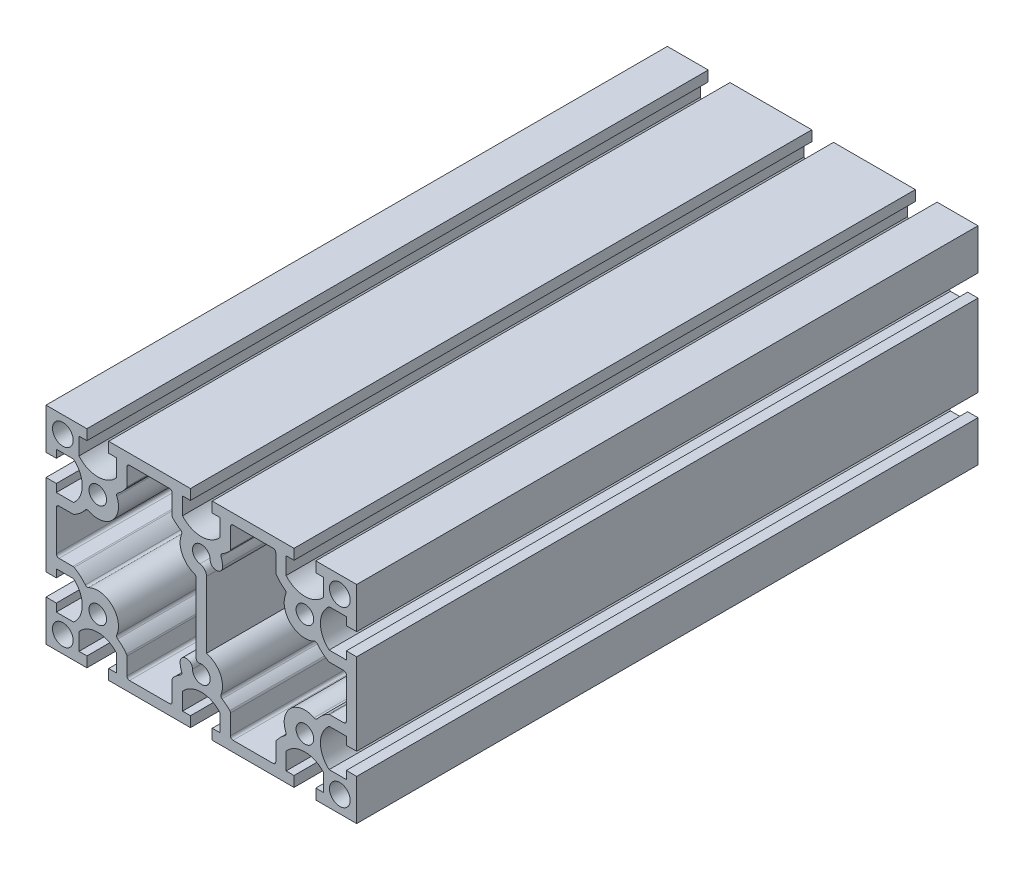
SolidWorks part; units mm, degrees
ref_plane "前基準面" through (0, 0, 0) normal (0, 0, 1) x (1, 0, 0)
ref_plane "上基準面" through (0, 0, 0) normal (0, 1, 0) x (1, 0, 0)
ref_plane "右基準面" through (0, 0, 0) normal (1, 0, 0) x (0, 0, -1)
sketch "草圖1" plane through (0, 0, 0) normal (0, 0, 1) x (1, 0, 0)
  line L0 (0, 40) -> (0, -40) construction
  line L1 (0, 0) -> (60, 0) construction
  line L2 (4.2, 40) -> (35.8, 40)
  line L3 (60, 40) -> (60, 24.2)
  line L4 (60, 20) -> (46, 20) construction
  line L5 (60, 24.2) -> (56, 24.2)
  line L6 (60, 15.8) -> (56, 15.8)
  line L7 (56, 27.25) -> (49.361, 27.25)
  line L8 (56, 27.25) -> (56, 24.2)
  line L9 (0, 36) -> (56, 36) construction
  line L10 (60, 15.8) -> (60, -15.8)
  line L11 (60, 40) -> (60, 0) construction
  line L12 (56, 12.75) -> (49.361, 12.75)
  line L13 (60, 27.25) -> (27.9715, 27.25) construction
  line L14 (60, 12.75) -> (27.9715, 12.75) construction
  line L15 (56, 36) -> (56, 0) construction
  line L16 (40, 40) -> (40, 29.3752) construction
  line L17 (60, 24.2) -> (27.9715, 24.2) construction
  line L18 (60, 20) -> (27.9715, 20) construction
  line L19 (60, 15.8) -> (27.9715, 15.8) construction
  line L20 (56, 15.8) -> (56, 12.75)
  line L21 (32.75, 36) -> (35.8, 36)
  line L22 (35.8, 40) -> (35.8, 36)
  line L23 (44.2, 40) -> (44.2, 36)
  line L24 (44.2, 36) -> (47.25, 36)
  line L25 (32.75, 36) -> (32.75, 29.361)
  line L26 (44.2, 40) -> (60, 40)
  line L27 (47.25, 36) -> (47.25, 29.361)
  line L28 (0, 40) -> (60, 40) construction
  line L29 (4.2, 40) -> (4.2, 36)
  line L30 (7.25, 36) -> (7.25, 29.361)
  line L31 (4.2, 36) -> (7.25, 36)
  line L32 (-40, 40) -> (-40, 29.3752) construction
  line L33 (-60, 20) -> (-46, 20) construction
  line L34 (-4.2, 36) -> (-7.25, 36)
  line L35 (-7.25, 36) -> (-4.2, 36)
  line L36 (-7.25, 36) -> (-7.25, 29.361)
  line L37 (-4.2, 40) -> (-4.2, 36)
  line L38 (-7.25, 36) -> (-7.25, 29.361)
  line L39 (-4.2, 40) -> (-4.2, 36)
  line L40 (-47.25, 36) -> (-47.25, 29.361)
  line L41 (-44.2, 40) -> (-60, 40)
  line L42 (-32.75, 36) -> (-32.75, 29.361)
  line L43 (-44.2, 36) -> (-47.25, 36)
  line L44 (-44.2, 40) -> (-44.2, 36)
  line L45 (-35.8, 40) -> (-35.8, 36)
  line L46 (-32.75, 36) -> (-35.8, 36)
  line L47 (-56, 15.8) -> (-56, 12.75)
  line L48 (-56, 12.75) -> (-49.361, 12.75)
  line L49 (-60, 15.8) -> (-60, -15.8)
  line L50 (-56, 27.25) -> (-56, 24.2)
  line L51 (-56, 27.25) -> (-49.361, 27.25)
  line L52 (-60, 15.8) -> (-56, 15.8)
  line L53 (-60, 24.2) -> (-56, 24.2)
  line L54 (-60, 40) -> (-60, 24.2)
  line L55 (-4.2, 40) -> (-35.8, 40)
  line L56 (-60, -20) -> (-46, -20) construction
  line L57 (-40, -40) -> (-40, -29.3752) construction
  line L58 (40, -40) -> (40, -29.3752) construction
  line L59 (60, -20) -> (46, -20) construction
  line L60 (-4.2, -40) -> (-35.8, -40)
  line L61 (-60, -40) -> (-60, -24.2)
  line L62 (-60, -24.2) -> (-56, -24.2)
  line L63 (-60, -15.8) -> (-56, -15.8)
  line L64 (-56, -27.25) -> (-49.361, -27.25)
  line L65 (-56, -27.25) -> (-56, -24.2)
  line L66 (-56, -12.75) -> (-49.361, -12.75)
  line L67 (-56, -15.8) -> (-56, -12.75)
  line L68 (-32.75, -36) -> (-35.8, -36)
  line L69 (-35.8, -40) -> (-35.8, -36)
  line L70 (-44.2, -40) -> (-44.2, -36)
  line L71 (-44.2, -36) -> (-47.25, -36)
  line L72 (-32.75, -36) -> (-32.75, -29.361)
  line L73 (-44.2, -40) -> (-60, -40)
  line L74 (-47.25, -36) -> (-47.25, -29.361)
  line L75 (-4.2, -40) -> (-4.2, -36)
  line L76 (-7.25, -36) -> (-7.25, -29.361)
  line L77 (-4.2, -36) -> (-7.25, -36)
  line L78 (4.2, -36) -> (7.25, -36)
  line L79 (7.25, -36) -> (7.25, -29.361)
  line L80 (4.2, -40) -> (4.2, -36)
  line L81 (47.25, -36) -> (47.25, -29.361)
  line L82 (44.2, -40) -> (60, -40)
  line L83 (32.75, -36) -> (32.75, -29.361)
  line L84 (44.2, -36) -> (47.25, -36)
  line L85 (44.2, -40) -> (44.2, -36)
  line L86 (35.8, -40) -> (35.8, -36)
  line L87 (32.75, -36) -> (35.8, -36)
  line L88 (56, -15.8) -> (56, -12.75)
  line L89 (56, -12.75) -> (49.361, -12.75)
  line L90 (56, -27.25) -> (56, -24.2)
  line L91 (56, -27.25) -> (49.361, -27.25)
  line L92 (60, -15.8) -> (56, -15.8)
  line L93 (60, -24.2) -> (56, -24.2)
  line L94 (60, -40) -> (60, -24.2)
  line L95 (4.2, -40) -> (35.8, -40)
  arc A0 (49.361, 27.25) -> (49.361, 12.75) centre (55.5, 20) ccw
  arc A1 (32.75, 29.361) -> (47.25, 29.361) centre (40, 35.5) ccw
  arc A2 (-7.25, 29.361) -> (7.25, 29.361) centre (0, 35.5) ccw
  arc A3 (-32.75, 29.361) -> (-47.25, 29.361) centre (-40, 35.5) cw
  arc A4 (-49.361, 27.25) -> (-49.361, 12.75) centre (-55.5, 20) cw
  arc A5 (-49.361, -27.25) -> (-49.361, -12.75) centre (-55.5, -20) ccw
  arc A6 (-32.75, -29.361) -> (-47.25, -29.361) centre (-40, -35.5) ccw
  arc A7 (-7.25, -29.361) -> (7.25, -29.361) centre (0, -35.5) cw
  arc A8 (32.75, -29.361) -> (47.25, -29.361) centre (40, -35.5) cw
  arc A9 (49.361, -27.25) -> (49.361, -12.75) centre (55.5, -20) cw
  point P109 (-60, 0)
  dimension "D10" = 4.5
  dimension "D7" = 9.5
  dimension "D13" = 9.5
  dimension "D1" = 120
  dimension "D2" = 80
  dimension "D3" = 20
  dimension "D11" = 40
  dimension "D12" = 4
  dimension "D14" = 8.4
  dimension "D15" = 14.5
  dimension "D16" = 2
  dimension "D4" = 4.2
  dimension "D5" = 4.2
  dimension "D6" = 4
  dimension "D8" = 7.25
  dimension "D9" = 7.25
extrude "填料-伸長1" add sketch "草圖1" along normal mid plane 240
sketch "草圖2" plane through (0, 0, 0) normal (0, 0, 1) x (1, 0, 0)
  line L0 (0, 0) -> (0, 40) construction
  line L1 (0, 0) -> (60, 0) construction
  line L2 (60, -15.8) -> (60, 15.8) construction
  circle A0 centre (53.5, 33.5) radius 4
  circle A1 centre (-53.5, 33.5) radius 4
  circle A2 centre (53.5, -33.5) radius 4
  circle A3 centre (-53.5, -33.5) radius 4
  circle A4 centre (40, 20) radius 3.4
  circle A5 centre (-40, 20) radius 3.4
  circle A6 centre (-40, -20) radius 3.4
  circle A7 centre (40, -20) radius 3.4
  circle A8 centre (0, 20) radius 3.4
  circle A9 centre (0, -20) radius 3.4
  dimension "D3" = 8
  dimension "D6" = 6.8
  dimension "D7" = 40
  dimension "D8" = 6.8
  dimension "D1" = 107
  dimension "D2" = 67
  dimension "D4" = 80
  dimension "D5" = 40
extrude "除料-伸長1" cut sketch "草圖2" against normal up to next and the other way up to next
sketch "草圖3" plane through (0, 0, 0) normal (0, 0, 1) x (1, 0, 0)
  line L0 (0, 0) -> (0, 40) construction
  line L1 (60, 0) -> (0, 0) construction
  line L2 (60, -15.8) -> (60, 15.8) construction
  line L3 (2, -12.0476) -> (2, 13.6786)
  line L4 (2, 0) -> (2, 40) construction
  line L5 (56, -15.8) -> (56, 15.8)
  line L6 (56, -7.75) -> (56, 7.75)
  line L7 (56, 12.75) -> (49.361, 12.75) construction
  line L9 (32.75, 29.361) -> (32.75, 36) construction
  line L10 (7.25, 36) -> (7.25, 29.361) construction
  line L11 (-2, -15.7151) -> (-2, 11.3029)
  line L12 (-11.25, 35) -> (-11.25, 27.369)
  line L13 (35.8, 36) -> (4.2, 36)
  line L14 (27.75, 36) -> (12.25, 36)
  line L15 (-27.75, 36) -> (-12.25, 36)
  line L16 (-28.75, 35) -> (-28.75, 28.3455)
  line L17 (-55, 8.75) -> (-49.6082, 8.75)
  line L18 (-56, -7.75) -> (-56, 7.75)
  line L19 (0, 0) -> (0, -40) construction
  line L20 (11.25, -35) -> (11.25, -27.369)
  line L21 (55, -8.75) -> (49.6082, -8.75)
  line L22 (28.75, -35) -> (28.75, -28.3455)
  line L23 (-55, -8.75) -> (-49.6082, -8.75)
  line L24 (-28.75, -35) -> (-28.75, -28.3455)
  line L25 (-27.75, -36) -> (-12.25, -36)
  line L26 (27.75, -36) -> (12.25, -36)
  line L27 (-11.25, -35) -> (-11.25, -27.369)
  line L88 (28.75, 35) -> (28.75, 28.3455)
  line L89 (55, 8.75) -> (49.6082, 8.75)
  line L90 (11.25, 35) -> (11.25, 27.369)
  arc A0 (44.7956, 12.5484) -> (49.1369, 8.868) centre (55.5, 20.7744) ccw
  arc A1 (55, 8.75) -> (56, 7.75) centre (55, 7.75) cw
  arc A2 (11.25, 35) -> (12.25, 36) centre (12.25, 35) cw
  arc A3 (32.6604, 23.1828) -> (43.558, 12.8347) centre (40, 20) ccw
  arc A4 (28.75, 35) -> (27.75, 36) centre (27.75, 35) ccw
  arc A5 (28.75, 28.3455) -> (28.93, 27.7731) centre (29.75, 28.3455) ccw
  arc A6 (49.6082, 8.75) -> (49.1369, 8.868) centre (49.6082, 9.75) cw
  arc A7 (43.558, 12.8347) -> (44.7956, 12.5484) centre (44.0027, 11.9391) cw
  arc A8 (32.6604, 23.1828) -> (32.3124, 24.4027) centre (31.7429, 23.5806) ccw
  arc A9 (11.25, 27.369) -> (10.9832, 26.689) centre (10.25, 27.369) cw
  arc A10 (7.6086, 23.0575) -> (8.0226, 24.2882) centre (8.5365, 23.4304) cw
  arc A11 (-2, 11.3029) -> (-2.6739, 12.2482) centre (-3, 11.3029) ccw
  arc A12 (8.0226, 24.2882) -> (10.9832, 26.689) centre (1.0851, 35.8693) ccw
  arc A13 (8.2, 20) -> (7.6086, 23.0575) centre (0, 20) ccw
  circle A14 centre (0, 20) radius 3.4 construction
  arc A15 (3.4, 20) -> (-0.5312, 16.6418) centre (0, 20) ccw
  arc A16 (8.2, 20) -> (3.4, 20) centre (5.8, 20) cw
  arc A17 (-0.5312, 16.6418) -> (2, 13.6786) centre (-1, 13.6786) cw
  arc A18 (-55, -8.75) -> (-56, -7.75) centre (-55, -7.75) cw
  arc A19 (-8.0226, -24.2882) -> (-10.9832, -26.689) centre (-1.0851, -35.8693) ccw
  arc A20 (29.6974, 26.7761) -> (50.3026, 26.7761) centre (40, 35.5) ccw
  arc A21 (28.93, 27.7731) -> (32.3124, 24.4027) centre (40, 35.5) ccw
  arc A22 (-2.6739, 12.2482) -> (-7.6086, 23.0575) centre (0, 20) cw
  arc A23 (-7.6086, 23.0575) -> (-8.0226, 24.2882) centre (-8.5365, 23.4304) ccw
  arc A24 (-8.0226, 24.2882) -> (-10.9832, 26.689) centre (-1.0851, 35.8693) cw
  arc A25 (-11.25, 27.369) -> (-10.9832, 26.689) centre (-10.25, 27.369) ccw
  arc A26 (-11.25, 35) -> (-12.25, 36) centre (-12.25, 35) ccw
  arc A27 (-28.75, 35) -> (-27.75, 36) centre (-27.75, 35) cw
  arc A28 (-28.75, 28.3455) -> (-28.93, 27.7731) centre (-29.75, 28.3455) cw
  arc A29 (-28.93, 27.7731) -> (-32.3124, 24.4027) centre (-40, 35.5) cw
  arc A30 (-32.6604, 23.1828) -> (-32.3124, 24.4027) centre (-31.7429, 23.5806) cw
  arc A31 (-32.6604, 23.1828) -> (-43.558, 12.8347) centre (-40, 20) cw
  arc A32 (-43.558, 12.8347) -> (-44.7956, 12.5484) centre (-44.0027, 11.9391) ccw
  arc A33 (-44.7956, 12.5484) -> (-49.1369, 8.868) centre (-55.5, 20.7744) cw
  arc A34 (-49.6082, 8.75) -> (-49.1369, 8.868) centre (-49.6082, 9.75) ccw
  arc A35 (-55, 8.75) -> (-56, 7.75) centre (-55, 7.75) ccw
  arc A36 (-49.6082, -8.75) -> (-49.1369, -8.868) centre (-49.6082, -9.75) cw
  arc A37 (-44.7956, -12.5484) -> (-49.1369, -8.868) centre (-55.5, -20.7744) ccw
  arc A38 (-43.558, -12.8347) -> (-44.7956, -12.5484) centre (-44.0027, -11.9391) cw
  arc A39 (-32.6604, -23.1828) -> (-43.558, -12.8347) centre (-40, -20) ccw
  arc A40 (-32.6604, -23.1828) -> (-32.3124, -24.4027) centre (-31.7429, -23.5806) ccw
  arc A41 (-28.93, -27.7731) -> (-32.3124, -24.4027) centre (-40, -35.5) ccw
  arc A42 (-28.75, -28.3455) -> (-28.93, -27.7731) centre (-29.75, -28.3455) ccw
  arc A43 (-28.75, -35) -> (-27.75, -36) centre (-27.75, -35) ccw
  arc A44 (-11.25, -35) -> (-12.25, -36) centre (-12.25, -35) cw
  arc A45 (-11.25, -27.369) -> (-10.9832, -26.689) centre (-10.25, -27.369) cw
  arc A47 (-2, -15.7151) -> (-0.7727, -16.689) centre (-1, -15.7151) ccw
  arc A49 (28.93, -27.7731) -> (32.3124, -24.4027) centre (40, -35.5) cw
  arc A50 (-7.6086, -23.0575) -> (-8.0226, -24.2882) centre (-8.5365, -23.4304) cw
  arc A56 (8.0226, -24.2882) -> (10.9832, -26.689) centre (1.0851, -35.8693) cw
  arc A58 (11.25, -27.369) -> (10.9832, -26.689) centre (10.25, -27.369) ccw
  arc A59 (32.6604, -23.1828) -> (32.3124, -24.4027) centre (31.7429, -23.5806) cw
  arc A60 (43.558, -12.8347) -> (44.7956, -12.5484) centre (44.0027, -11.9391) ccw
  arc A61 (49.6082, -8.75) -> (49.1369, -8.868) centre (49.6082, -9.75) ccw
  arc A62 (28.75, -28.3455) -> (28.93, -27.7731) centre (29.75, -28.3455) cw
  arc A63 (28.75, -35) -> (27.75, -36) centre (27.75, -35) cw
  arc A64 (32.6604, -23.1828) -> (43.558, -12.8347) centre (40, -20) cw
  arc A65 (11.25, -35) -> (12.25, -36) centre (12.25, -35) ccw
  arc A66 (55, -8.75) -> (56, -7.75) centre (55, -7.75) ccw
  arc A67 (44.7956, -12.5484) -> (49.1369, -8.868) centre (55.5, -20.7744) cw
  arc A68 (7.6086, -23.0575) -> (8.0226, -24.2882) centre (8.5365, -23.4304) ccw
  arc A69 (2, -12.0476) -> (7.6086, -23.0575) centre (0, -20) cw
  arc A70 (-3.4, -20) -> (-0.7727, -16.689) centre (0, -20) ccw
  arc A72 (-8.2, -20) -> (-7.6086, -23.0575) centre (0, -20) ccw
  arc A73 (-8.2, -20) -> (-3.4, -20) centre (-5.8, -20) cw
  point P16 (2, -17.2505)
  point P60 (2, 17.2505)
  point P64 (56, 0)
  point P100 (-2, 0)
  point P180 (-56, 0)
  dimension "D3" = 1
  dimension "D6" = 16
  dimension "D7" = 1
  dimension "D9" = 4
  dimension "D4" = 1
  dimension "D10" = 13.5
  dimension "D12" = 13.5
  dimension "D13" = 4.8
  dimension "D14" = 3
  dimension "D16" = 1
  dimension "D18" = 3.4
  dimension "D19" = 8.2
  dimension "D20" = 1
  dimension "D21" = 8.2
  dimension "D22" = 1
  dimension "D23" = 13.5
  dimension "D11" = 4
  dimension "D15" = 4
  dimension "D17" = 2
  dimension "D1" = 4
  dimension "D2" = 4
  dimension "D5" = 4
  dimension "D8" = 2
extrude "除料-伸長2" cut sketch "草圖3" against normal up to next and the other way up to next
